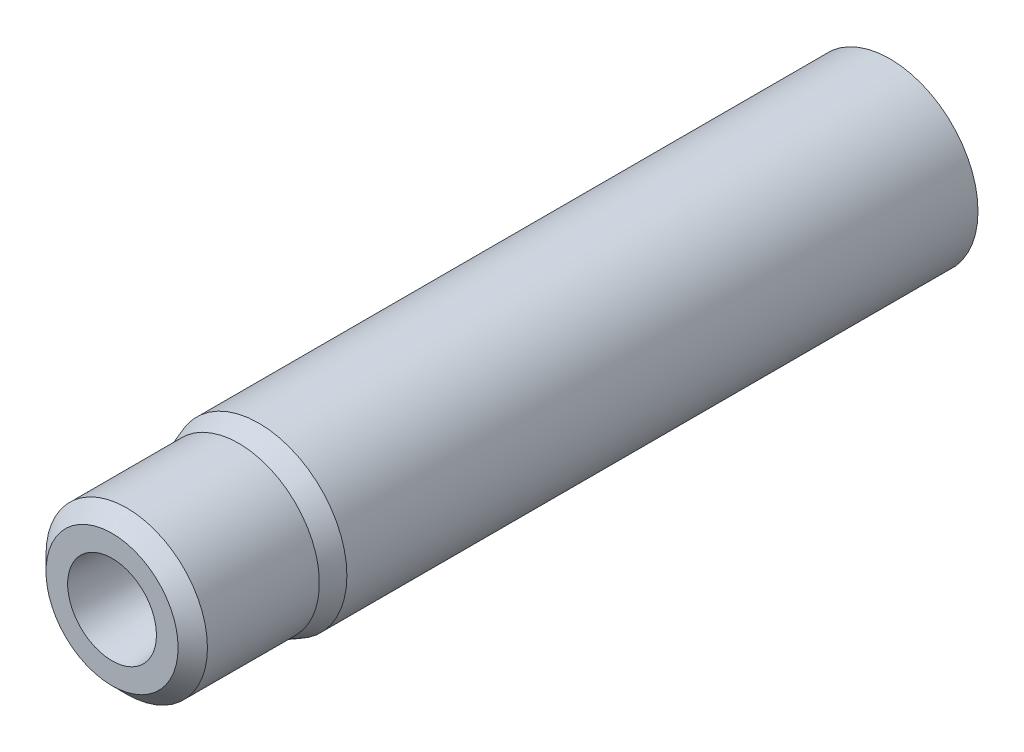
SolidWorks part; units mm, degrees
ref_plane "Front Plane" through (0, 0, 0) normal (0, 0, 1) x (1, 0, 0)
ref_plane "Top Plane" through (0, 0, 0) normal (0, 1, 0) x (1, 0, 0)
ref_plane "Right Plane" through (0, 0, 0) normal (1, 0, 0) x (0, 0, -1)
sketch "Sketch1" plane through (0, 0, 0) normal (0, 0, 1) x (1, 0, 0)
  circle A0 centre (0, 0) radius 6
  dimension "D1" = 12
extrude "Boss-Extrude1" add sketch "Sketch1" along normal blind 45
sketch "Sketch2" plane through (0, 0, 45) normal (0, 0, 1) x (1, 0, 0)
  circle A0 centre (0, 0) radius 5.5
  dimension "D1" = 11
extrude "Boss-Extrude2" add sketch "Sketch2" along normal blind 8
hole_wizard "M6 Tapped Hole1" positions "Sketch3" profile "Sketch4" tap size "M6" standard "ISO"
sketch "Sketch3" plane through (0, 0, 53) normal (0, 0, 1) x (1, 0, 0)
  point P0 (0, 0)
sketch "Sketch4" plane through (0, 0, 53) normal (1, 0, 0) x (0, -1, 0)
  line L0 (0, 0) -> (0, 16.5022)
  line L1 (0, 16.5022) -> (2.5, 15)
  line L2 (2.5, 15) -> (2.5, 4.995)
  line L3 (2.5, 4.995) -> (3.025, 0)
  line L5 (3.025, 0) -> (0, 0)
  line L6 (-2.5, 4.995) -> (-3.025, 0) construction
  line L10 (0, 16.5022) -> (-2.5, 15) construction
  line L11 (0, -6.35) -> (0, 107.95) construction
  dimension "Tap Drill Dia." = 5
  dimension "Tap Drill Depth" = 15
  dimension "Near C'Sink Dia." = 6.05
  dimension "Near C'Sink Angle" = 12
  dimension "Drill Angle" = 118
chamfer "Chamfer1" distance 2 angle 20 1 edges at (6, 0, 45)
chamfer "Chamfer2" distance 1 angle 45 1 edges at (5.5, 0, 53)
